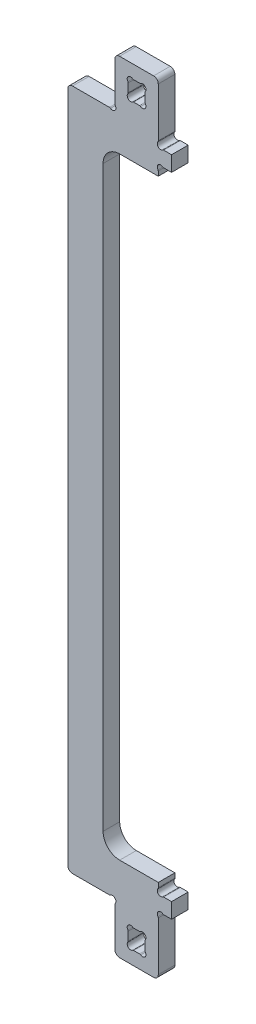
SolidWorks part; units mm, degrees
ref_plane "Plan de face" through (0, 0, 0) normal (0, 0, 1) x (1, 0, 0)
ref_plane "Plan de dessus" through (0, 0, 0) normal (0, 1, 0) x (1, 0, 0)
ref_plane "Plan de droite" through (0, 0, 0) normal (1, 0, 0) x (0, 0, -1)
sketch "Esquisse2" plane through (0, 0, 0) normal (0, 0, 1) x (1, 0, 0)
  line L0 (70.8, 0) -> (67.1938, -3.6062) construction
  line L1 (70.8, -74.1667) -> (136, -74.1667)
  line L2 (70.8, -74.1667) -> (70.8, -8.131)
  line L3 (107, 26.5) -> (156, 26.5) construction
  line L4 (144.131, 15) -> (156, 15)
  line L5 (156, 15) -> (156, 38)
  line L6 (136, 15) -> (139.6062, 11.3938) construction
  line L7 (62.669, 0) -> (0, 0)
  line L8 (107, 53) -> (107, 0) construction
  line L9 (78, 53) -> (136, 53)
  line L10 (144.131, 38) -> (156, 38)
  line L11 (136, -74.1667) -> (136, 6.869)
  line L12 (136, 53) -> (136, 46.131)
  line L13 (0, 0) -> (0, 512.8333)
  line L14 (53, 78) -> (53, 512.8333)
  line L15 (53, 512.8333) -> (0, 512.8333)
  line L16 (0, 1099.8333) -> (0, -74.1667) construction
  line L19 (107, 0) -> (62.669, 0) construction
  line L21 (103.4, -41.5667) -> (103.4, -54.1667) construction
  line L23 (116, -33.131) -> (116, -46.0356)
  line L24 (98.931, -25) -> (107.869, -25)
  line L25 (90.8, -39.5833) -> (116, -39.5833) construction
  line L26 (90.8, -33.131) -> (90.8, -46.0356)
  line L27 (98.931, -54.1667) -> (107.869, -54.1667)
  line L28 (90.8, -54.1667) -> (103.4, -41.5667) construction
  arc A0 (71.2914, -6.6426) -> (64.1574, 0.4914) centre (67.1938, -3.6062) ccw
  arc A1 (70.8, -8.131) -> (71.2914, -6.6426) centre (73.3, -8.131) cw
  arc A2 (64.1574, 0.4914) -> (62.669, 0) centre (62.669, 2.5) cw
  arc A3 (142.6426, 15.4914) -> (135.5086, 8.3574) centre (139.6062, 11.3938) ccw
  arc A4 (142.6426, 15.4914) -> (144.131, 15) centre (144.131, 17.5) ccw
  arc A5 (135.5086, 8.3574) -> (136, 6.869) centre (133.5, 6.869) cw
  arc A6 (142.6426, 37.5086) -> (144.131, 38) centre (144.131, 35.5) cw
  arc A7 (142.6426, 37.5086) -> (135.5086, 44.6426) centre (139.6062, 41.6062) cw
  arc A8 (135.5086, 44.6426) -> (136, 46.131) centre (133.5, 46.131) ccw
  arc A9 (53, 78) -> (78, 53) centre (78, 78) ccw
  arc A10 (90.3086, -47.524) -> (97.4426, -54.658) centre (94.4062, -50.5604) ccw
  arc A11 (90.3086, -47.524) -> (90.8, -46.0356) centre (88.3, -46.0356) ccw
  arc A12 (97.4426, -54.658) -> (98.931, -54.1667) centre (98.931, -56.6667) cw
  arc A13 (109.3574, -54.658) -> (107.869, -54.1667) centre (107.869, -56.6667) ccw
  arc A14 (116.4914, -47.524) -> (109.3574, -54.658) centre (112.3938, -50.5604) cw
  arc A15 (116.4914, -47.524) -> (116, -46.0356) centre (118.5, -46.0356) cw
  arc A16 (116.4914, -31.6426) -> (116, -33.131) centre (118.5, -33.131) ccw
  arc A17 (116.4914, -31.6426) -> (109.3574, -24.5086) centre (112.3938, -28.6062) ccw
  arc A18 (109.3574, -24.5086) -> (107.869, -25) centre (107.869, -22.5) cw
  arc A19 (97.4426, -24.5086) -> (98.931, -25) centre (98.931, -22.5) ccw
  arc A20 (90.3086, -31.6426) -> (97.4426, -24.5086) centre (94.4062, -28.6062) cw
  arc A21 (90.3086, -31.6426) -> (90.8, -33.131) centre (88.3, -33.131) cw
  point P43 (0, 512.8333)
  point P49 (107, 26.5)
  point P64 (103.4, -54.1667)
  point P83 (103.4, -74.1667)
extrude "Boss.-Extru.2" add sketch "Esquisse2" along normal blind 25
fillet "Congé1" radius 7 3 edges at (70.8, -74.1667, 12.5) (136, -74.1667, 12.5) (0, 0, 12.5)
mirror "Symétrie1" about plane through (53, 512.8333, 25) normal (0, -1, 0)
equation "\"D1@Boss.-Extru.2\" = \"material_thickness\""
equation "\"D4@Esquisse2\"= \"tool_diameter\" / 2 + \"hole_clearance\""
equation "\"tool_diameter\"=10"
equation "\"hole_clearance\"=0.1"
equation "\"material_thickness\"=25"
equation "\"clearance\"=0.1"
equation "\"outer_slot\"=0.5"
equation "\"fillet\"=7"
equation "\"D7@Esquisse2\"=\"material_thickness\"/10"
equation "\"string\"= 2 * \"tool_diameter\" / 2 * cos ( 45deg )"
equation "\"angle\"= IIF ( \"string\" < \"limit\" , 45 , ( 180 - 2 * arcsin ( \"ThicknessVStool_dia\" ) ) / 2 )"
equation "\"limit\"= \"material_thickness\" / 2 * 5 / 6"
equation "\"ThicknessVStool_dia\"= IIF ( \"limit\" / \"tool_diameter\" > 1 , 1 , \"limit\" / \"tool_diameter\" )"
equation "\"D1@Congé1\"=\"fillet\""
equation "\"D10@Esquisse2\"=\"material_thickness\"/10"
equation "\"D8@Esquisse2\"=\"tool_diameter\"/2 + \"hole_clearance\""
equation "\"D11@Esquisse2\"=\"material_thickness\""
equation "\"D6@Esquisse2\"=\"material_thickness\"/2 + \"clearance\""
equation "\"D5@Esquisse2\"=\"material_thickness\"/2*7/6"
equation "\"D15@Esquisse2\"=\"tool_diameter\"/2 +\"hole_clearance\" "
equation "\"D16@Esquisse2\"=\"material_thickness\"/10"
equation "\"D2@Esquisse2\"=\"angle\""
